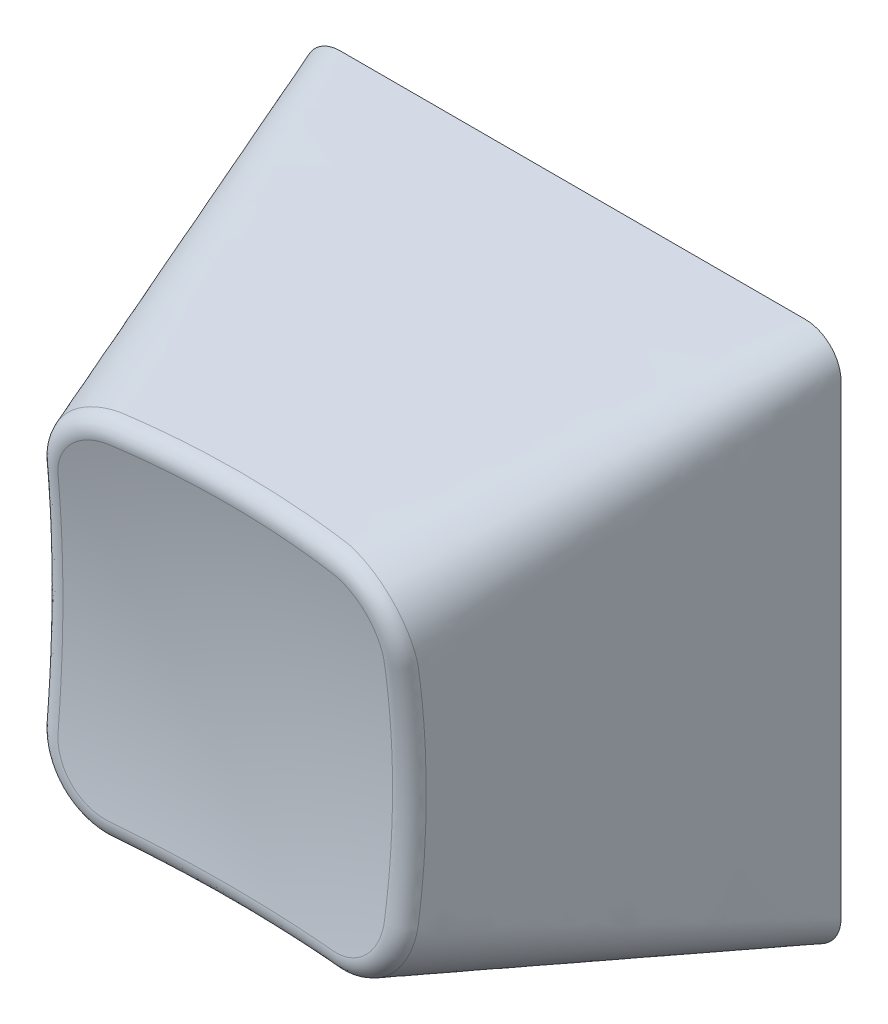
SolidWorks part; units mm, degrees
ref_plane "Front Plane" through (0, 0, 0) normal (0, 0, 1) x (1, 0, 0)
ref_plane "Top Plane" through (0, 0, 0) normal (0, 1, 0) x (1, 0, 0)
ref_plane "Right Plane" through (0, 0, 0) normal (1, 0, 0) x (0, 0, -1)
sketch "Sketch1" plane through (0, 0, 0) normal (0, 0, 1) x (1, 0, 0)
  line L1 (-8.255, 9.525) -> (8.255, 9.525)
  line L2 (-9.525, 8.255) -> (-9.525, -8.255)
  line L3 (-8.255, -9.525) -> (8.255, -9.525)
  line L4 (9.525, 8.255) -> (9.525, -8.255)
  line L5 (-9.525, 9.525) -> (9.525, -9.525) construction
  line L6 (-9.525, -9.525) -> (9.525, 9.525) construction
  arc A0 (-9.525, -8.255) -> (-8.255, -9.525) centre (-8.255, -8.255) ccw
  arc A1 (8.255, -9.525) -> (9.525, -8.255) centre (8.255, -8.255) ccw
  arc A2 (8.255, 9.525) -> (9.525, 8.255) centre (8.255, 8.255) cw
  arc A3 (-8.255, 9.525) -> (-9.525, 8.255) centre (-8.255, 8.255) ccw
  point P0 (0, 0)
  dimension "D2" = 1.27
  dimension "D1" = 19.05
ref_plane "Plane1" through (0, 0, 12.7) normal (0, 0, 1) x (1, 0, 0)
sketch "Sketch2" plane through (0, 0, 12.7) normal (0, 0, 1) x (1, 0, 0)
  line L1 (-3.81, 6.35) -> (3.81, 6.35)
  line L2 (-6.35, 3.81) -> (-6.35, -3.81)
  line L3 (-3.81, -6.35) -> (3.81, -6.35)
  line L4 (6.35, 3.81) -> (6.35, -3.81)
  line L5 (-6.35, 6.35) -> (6.35, -6.35) construction
  line L6 (-6.35, -6.35) -> (6.35, 6.35) construction
  arc A0 (-6.35, -3.81) -> (-3.81, -6.35) centre (-3.81, -3.81) ccw
  arc A1 (3.81, -6.35) -> (6.35, -3.81) centre (3.81, -3.81) ccw
  arc A2 (3.81, 6.35) -> (6.35, 3.81) centre (3.81, 3.81) cw
  arc A3 (-3.81, 6.35) -> (-6.35, 3.81) centre (-3.81, 3.81) ccw
  point P0 (0, 0)
  dimension "D2" = 2.54
  dimension "D1" = 12.7
loft "Loft1" add profiles "Sketch1", "Sketch2"
sketch "Sketch3" plane through (0, 0, 0) normal (1, 0, 0) x (0, 0, -1)
  line L0 (0, 0) -> (-11.7348, 0) construction
  line L1 (-11.7348, 0) -> (-78.4388, 0) construction
  line L2 (-11.7348, 0) -> (-78.4388, 0)
  arc A0 (-78.4388, 0) -> (-11.7348, 0) centre (-45.0868, 0) ccw
  dimension "D1" = 11.7348
  dimension "D3" = 33.352
revolve "Cut-Revolve2" cut sketch "Sketch3" angle 360 about L2
fillet "Fillet1" radius 0.635 1 edges at (6.4211, -1.93, 12.4157)
sketch "Sketch4" plane through (0, 0, 0) normal (0, 0, -1) x (-1, 0, 0)
  line L1 (-7.62, -8.89) -> (7.62, -8.89)
  line L2 (-8.89, -7.62) -> (-8.89, 7.62)
  line L3 (-7.62, 8.89) -> (7.62, 8.89)
  line L4 (8.89, -7.62) -> (8.89, 7.62)
  line L5 (-8.89, -8.89) -> (8.89, 8.89) construction
  line L6 (-8.89, 8.89) -> (8.89, -8.89) construction
  arc A0 (-7.62, -8.89) -> (-8.89, -7.62) centre (-7.62, -7.62) cw
  arc A1 (7.62, -8.89) -> (8.89, -7.62) centre (7.62, -7.62) ccw
  arc A2 (7.62, 8.89) -> (8.89, 7.62) centre (7.62, 7.62) cw
  arc A3 (-8.89, 7.62) -> (-7.62, 8.89) centre (-7.62, 7.62) cw
  point P0 (0, 0)
  dimension "D1" = 1.27
extrude "Cut-Extrude8" cut sketch "Sketch4" against normal offset from surface 1.27 draft 15
sketch "Sketch5" plane through (0, 0, 0) normal (0, 0, -1) x (-1, 0, 0)
  circle A0 centre (0, 0) radius 2.7559
extrude "Boss-Extrude1" add sketch "Sketch5" against normal up to surface (10.5747 mm away)
sketch "Sketch6" plane through (0, 0, 0) normal (0, 0, -1) x (-1, 0, 0)
  line L0 (-0.5969, -0.5969) -> (-0.5969, -2.0193)
  line L1 (-0.5969, 2.0193) -> (0.5969, 2.0193)
  line L2 (-0.5969, 2.0193) -> (-0.5969, 0.5969)
  line L3 (-0.5969, -2.0193) -> (0.5969, -2.0193)
  line L4 (0.5969, 2.0193) -> (0.5969, 0.5969)
  line L5 (-0.5969, 2.0193) -> (0.5969, -2.0193) construction
  line L6 (-0.5969, -2.0193) -> (0.5969, 2.0193) construction
  line L7 (-2.0193, 0.5969) -> (-0.5969, 0.5969)
  line L8 (-2.0193, 0.5969) -> (-2.0193, -0.5969)
  line L9 (-2.0193, -0.5969) -> (-0.5969, -0.5969)
  line L10 (2.0193, 0.5969) -> (2.0193, -0.5969)
  line L11 (-2.0193, 0.5969) -> (2.0193, -0.5969) construction
  line L12 (-2.0193, -0.5969) -> (2.0193, 0.5969) construction
  line L13 (0.5969, 0.5969) -> (2.0193, 0.5969)
  line L14 (0.5969, -0.5969) -> (0.5969, -2.0193)
  line L15 (0.5969, -0.5969) -> (2.0193, -0.5969)
  point P0 (0, 0)
  point P6 (0, 0)
  dimension "D1" = 1.1938
  dimension "D2" = 1.1938
  dimension "D3" = 4.0386
  dimension "D4" = 4.0386
extrude "Cut-Extrude9" cut sketch "Sketch6" against normal up to surface (10.4751 mm away)
